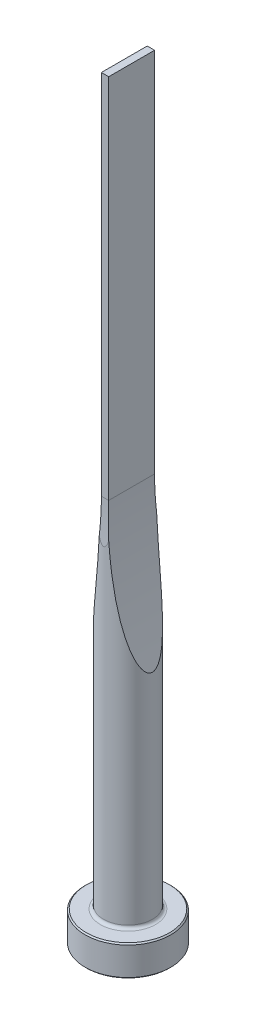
SolidWorks part; units mm, degrees
ref_plane "Front Plane" through (0, 0, 0) normal (0, 0, 1) x (1, 0, 0)
ref_plane "Top Plane" through (0, 0, 0) normal (0, 1, 0) x (1, 0, 0)
ref_plane "Right Plane" through (0, 0, 0) normal (1, 0, 0) x (0, 0, -1)
sketch "Sketch1" plane through (0, 0, 0) normal (0, 0, 1) x (1, 0, 0)
  line L0 (0, 0) -> (6.8, 0)
  line L1 (55, 0) -> (-55, 0) construction
  line L2 (7, 0.2) -> (7, 4.8)
  line L3 (6.8, 5) -> (4.5, 5)
  line L4 (4, 5.5) -> (4, 125)
  line L5 (0, 125) -> (4, 125)
  line L6 (7, 4.8) -> (6.8, 5)
  line L7 (6.8, 0) -> (7, 0.2)
  line L8 (0, 125) -> (0, 0)
  arc A0 (4, 5.5) -> (4.5, 5) centre (4.5, 5.5) ccw
  point P1 (7, 0)
  point P6 (7, 5)
  dimension "D4" = 0.5
  dimension "D1" = 4
  dimension "D2" = 7
  dimension "D3" = 5
  dimension "D5" = 125
revolve "Revolve1" add sketch "Sketch1" angle 360 about L8
sketch "Sketch2" plane through (0, 0, 0) normal (0, 0, 1) x (1, 0, 0)
  line L0 (0.6, 125) -> (0.6, 65)
  line L1 (4, 125) -> (-4, 125) construction
  line L2 (-0.6, 125) -> (-0.6, 65)
  line L3 (4, 125) -> (4, 40.4961)
  line L4 (-4, 125) -> (-4, 40.4961)
  line L5 (0, -7.7) -> (0, 7.7) construction
  line L6 (4, 125) -> (0.6, 125)
  line L8 (-0.6, 125) -> (-4, 125)
  arc A0 (0.6, 65) -> (4, 40.4961) centre (90.6, 65) ccw
  arc A1 (-0.6, 65) -> (-4, 40.4961) centre (-90.6, 65) cw
  dimension "D4" = 90
  dimension "D1" = 60
  dimension "D2" = 1.2
  dimension "D3" = 0.6
extrude "Cut-Extrude1" cut sketch "Sketch2" against normal mid plane 10
sketch "Sketch3" plane through (0, 0, 0) normal (1, 0, 0) x (0, 0, -1)
  line L0 (3.75, 125) -> (3.75, 65)
  line L1 (-3.9547, 125) -> (3.9547, 125) construction
  line L2 (-3.75, 125) -> (-3.75, 65)
  line L3 (4, 125) -> (4, 58.2965)
  line L4 (3.75, 125) -> (4, 125)
  line L5 (0, 7.7) -> (0, -7.7) construction
  line L6 (-4, 125) -> (-4, 58.2965)
  line L8 (-3.75, 125) -> (-4, 125)
  arc A0 (3.75, 65) -> (4, 58.2965) centre (93.75, 65) ccw
  arc A1 (-3.75, 65) -> (-4, 58.2965) centre (-93.75, 65) cw
  dimension "D2" = 90
  dimension "D1" = 60
  dimension "D3" = 7.5
  dimension "D4" = 3.75
extrude "Cut-Extrude2" cut sketch "Sketch3" against normal mid plane 10
